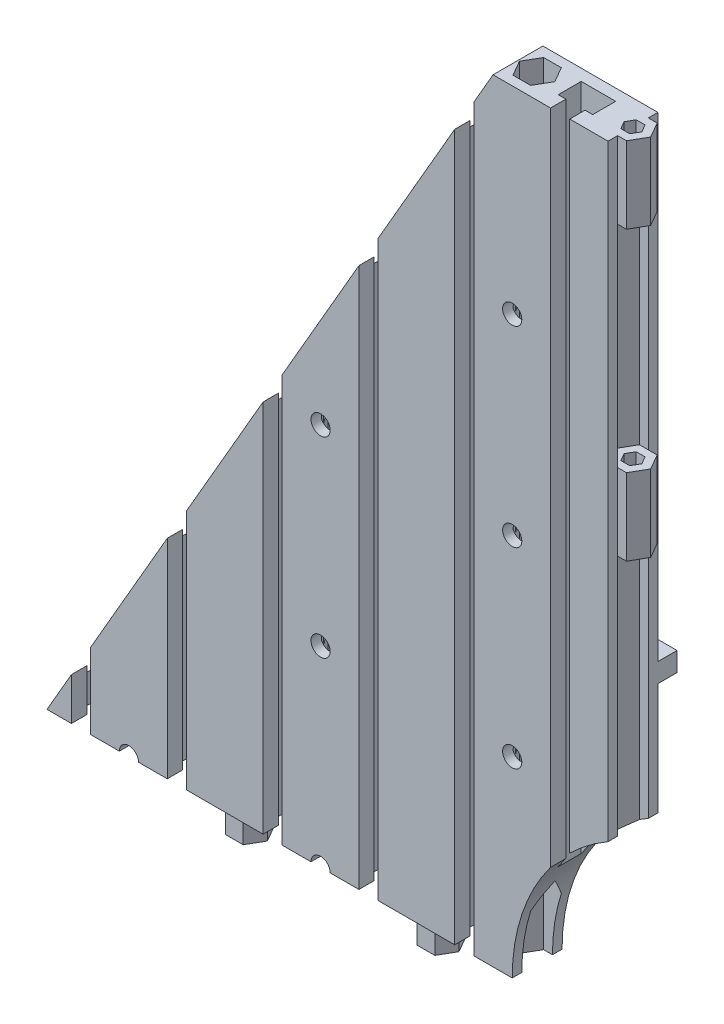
SolidWorks part; units mm, degrees
ref_plane "Plan de face" through (0, 0, 0) normal (0, 0, 1) x (1, 0, 0)
ref_plane "Plan de dessus" through (0, 0, 0) normal (0, 1, 0) x (1, 0, 0)
ref_plane "Plan de droite" through (0, 0, 0) normal (1, 0, 0) x (0, 0, -1)
sketch "Esquisse1" plane through (0, 0, 0) normal (0, 0, 1) x (1, 0, 0)
  line L6 (35.7636, 358.7862) -> (-423.8647, -437.3133) construction
  line L7 (-755.4678, -148.4209) -> (879.7592, -148.4209) construction
  line L8 (-46.1325, 376.7457) -> (415.4529, -422.7436) construction
  line L9 (257.0726, -148.4209) -> (-245.0999, 141.5085) construction
  line L10 (-257.0726, -148.4209) -> (263.2247, 151.9729) construction
  line L11 (-55, 201.5791) -> (55, 201.5791)
  line L12 (-147.0726, -148.4209) -> (147.0726, -148.4209)
  line L13 (147.0726, -148.4209) -> (202.0726, -53.1581)
  line L14 (202.0726, -53.1581) -> (55, 201.5791)
  line L15 (-147.0726, -148.4209) -> (-202.0726, -53.1581)
  line L16 (-202.0726, -53.1581) -> (-55, 201.5791)
  dimension "D1" = 60
  dimension "D2" = 60
  dimension "D3" = 110
  dimension "D4" = 350
  dimension "D5" = 60
  dimension "D6" = 60
  dimension "D7" = 110
  dimension "D8" = 110
extrude "Boss.-Extru.2" add sketch "Esquisse1" along normal blind 13
sketch "Esquisse3" plane through (0, 201.5791, 0) normal (0, 1, 0) x (1, 0, 0)
  line L0 (-12.5, 6.793) -> (-12.5, -19.2478) construction
  line L1 (-8, -3) -> (-17, -3)
  line L2 (-17, -3) -> (-17, -9)
  line L3 (-17, -9) -> (-15, -9)
  line L4 (-15, -9) -> (-15, -13)
  line L5 (55, -13) -> (-55, -13) construction
  line L6 (-10, -9) -> (-10, -13)
  line L7 (-8, -9) -> (-10, -9)
  line L8 (-8, -3) -> (-8, -9)
  line L9 (-15, -13) -> (-10, -13)
  point P2 (-12.5, -13)
  point P14 (-12.5, -3)
  dimension "D1" = 12.5
  dimension "D2" = 9
  dimension "D3" = 5
  dimension "D4" = 6
  dimension "D5" = 4
extrude "Enlèv. mat.-Extru.1" cut sketch "Esquisse3" against normal up to next
pattern_linear "Répétition linéaire1" count 8 spacing 25 along (1, 0, 0) of "Enlèv. mat.-Extru.1"
pattern_linear "Répétition linéaire2" count 7 spacing 25 along (-1, 0, 0) of "Enlèv. mat.-Extru.1"
sketch "certcleRotules" plane through (0, 0, 13) normal (0, 0, 1) x (1, 0, 0)
  circle A0 centre (0, 0) radius 157.5
  dimension "D1" = 315
sketch "Esquisse6" plane through (0, 0, 0) normal (0, 1, 0) x (1, 0, 0)
  line L0 (-157.5, -13) -> (157.5, -13) construction
  line L1 (0, 0) -> (-4.5, 0)
  line L2 (0, 0) -> (0, -13)
  line L3 (-2.5, -9) -> (-4.5, -9)
  line L4 (-4.5, 0) -> (-4.5, -9)
  line L7 (0, -13) -> (-2.5, -13)
  line L8 (-2.5, -9) -> (-2.5, -13)
  dimension "D1" = 4.5
  dimension "D2" = 2.5
  dimension "D3" = 4
revolve "Enlèvement de matière-Révolution1" cut sketch "Esquisse6" angle 360 about L2
pattern_linear "Répétition linéaire3" count 4 spacing 50 along (0, 1, 0) count 4 spacing 50 along (1, 0, 0) of "Enlèvement de matière-Révolution1"
pattern_linear "Répétition linéaire5" count 3 spacing 50 along (0, -1, 0) count 4 spacing 50 along (1, 0, 0) of "Enlèvement de matière-Révolution1"
pattern_linear "Répétition linéaire6" count 4 spacing 50 along (0, 1, 0) count 4 spacing 50 along (-1, 0, 0) of "Enlèvement de matière-Révolution1"
pattern_linear "Répétition linéaire7" count 3 spacing 50 along (0, -1, 0) count 4 spacing 50 along (-1, 0, 0) of "Enlèvement de matière-Révolution1"
sketch "Esquisse8" plane through (0, 0, 0) normal (0, 0, -1) x (-1, 0, 0)
  circle A0 centre (0, 100) radius 4.5 construction
  circle A1 centre (0, 100) radius 4.5
extrude "bouchonBarreauHaut" add sketch "Esquisse8" against normal blind 13
sketch "Esquisse7" plane through (0, 0, 0) normal (0, 0, -1) x (-1, 0, 0)
  line L1 (-6.5, 105.15) -> (6.5, 105.15)
  line L2 (-6.5, 105.15) -> (-6.5, 80.15)
  line L3 (-6.5, 80.15) -> (6.5, 80.15)
  line L4 (6.5, 105.15) -> (6.5, 80.15)
  line L5 (0, 7.15) -> (0, -7.15) construction
  dimension "D1" = 25
  dimension "D2" = 80.15
  dimension "D3" = 13
  dimension "D4" = 6.5
extrude "Boss.-Extru.4" add sketch "Esquisse7" along normal blind 5
sketch "4parties" plane through (0, 0, 0) normal (0, 0, 1) x (1, 0, 0)
  line L0 (-25, 201.5791) -> (-25, 43.3013)
  line L1 (-55, 201.5791) -> (55, 201.5791) construction
  line L2 (-50, 0) -> (-171.3817, 0)
  line L3 (-165, 11.0535) -> (-202.0726, -53.1581) construction
  line L4 (50, 0) -> (171.3817, 0)
  line L5 (202.0726, -53.1581) -> (165, 11.0535) construction
  line L6 (0, -50) -> (0, -148.4209)
  line L7 (-10, -148.4209) -> (10, -148.4209) construction
  circle A0 centre (0, 0) radius 50
  dimension "D1" = 100
  dimension "D2" = 10
sketch "Esquisse9" plane through (0, 0, 0) normal (1, 0, 0) x (0, 0, -1)
  line L0 (5, 80.15) -> (0, 80.15) construction
  line L1 (5, 80.15) -> (5, 105.15) construction
  line L3 (5, 85.15) -> (5, 82.5)
  line L4 (5, 82.5) -> (-3, 82.5)
  line L6 (-3, -148.4209) -> (-3, 201.5791) construction
  line L7 (-13, 157.5) -> (-13, -157.5) construction
  line L8 (-3, 79.15) -> (-13, 79.15)
  line L9 (-3, 79.15) -> (-3, 82.5)
  line L10 (5, 85.15) -> (-13, 85.15)
  line L11 (-13, 79.15) -> (-13, 85.15)
  dimension "D1" = 5
  dimension "D2" = 2.65
  dimension "D3" = 6
revolve "Enlèvement de matière-Révolution2" cut sketch "Esquisse9" angle 360 about L10
pattern_linear "Répétition linéaire8" count 2 spacing 15 along (0, 1, 0) of "Enlèvement de matière-Révolution2"
pattern_circular "Répétition circulaire1" count 3 every 120 about axis through (0, 0, 0) along (0, 0, 1) of "Boss.-Extru.4", "Enlèvement de matière-Révolution2", "Répétition linéaire8"
sketch "Esquisse10" plane through (0, 0, 0) normal (1, 0, 0) x (0, 0, -1)
  line L0 (0, 201.5791) -> (0, -53.1581) construction
  line L1 (0, 77.5) -> (5, 77.5)
  line L2 (0, 77.5) -> (0, 72.5)
  line L3 (0, 72.5) -> (5, 72.5)
  line L4 (5, 77.5) -> (5, 72.5)
  line L5 (0, 50) -> (0, -50) construction
  line L6 (0, -72.5) -> (5, -72.5)
  line L7 (0, -72.5) -> (0, -77.5)
  line L8 (0, -77.5) -> (5, -77.5)
  line L9 (5, -72.5) -> (5, -77.5)
  line L10 (5, 80.15) -> (5, 105.15) construction
  line L11 (-9, 50) -> (0, 50) construction
  line L13 (-9, -100) -> (0, -100) construction
  point P16 (2.5, 72.5)
  point P19 (2.5, -72.5)
  dimension "D1" = 22.5
  dimension "D2" = 5
  dimension "D3" = 22.5
  dimension "D4" = 5
extrude "Boss.-Extru.6" add sketch "Esquisse10" along normal mid plane 250
chamfer "Chanfrein1" distance 5 angle 60 4 edges at (125, -75, -5) (-125, -75, -5) (-125, 75, -5) (125, 75, -5)
sketch "Esquisse11" plane through (0, 0, 13) normal (0, 0, 1) x (1, 0, 0)
  line L0 (-10, -148.4209) -> (-10, 201.5791) construction
  line L1 (-10, 23.5) -> (10, 23.5)
  line L2 (-10, 23.5) -> (-10, -23.5)
  line L3 (-10, -23.5) -> (10, -23.5)
  line L4 (10, 23.5) -> (10, -23.5)
  line L5 (10, -148.4209) -> (10, 201.5791) construction
  dimension "D1" = 47
  dimension "D2" = 23.5
extrude "Enlèv. mat.-Extru.2" cut sketch "Esquisse11" against normal blind 8.9
sketch "Esquisse13" plane through (-8, 0, 0) normal (-1, 0, 0) x (0, 0, 1)
  line L1 (4.1, -23.5) -> (11.1, -23.5)
  line L2 (4.1, -23.5) -> (4.1, -40)
  line L3 (4.1, -40) -> (6.1, -40)
  line L4 (11.1, -23.5) -> (11.1, -35)
  arc A0 (6.1, -40) -> (11.1, -35) centre (6.1, -35) ccw
  dimension "D2" = 5
  dimension "D1" = 16.5
  dimension "D3" = 7
extrude "Enlèv. mat.-Extru.3" cut sketch "Esquisse13" against normal up to surface (16 mm away)
sketch "Esquisse14" plane through (0, 0, 4.1) normal (0, 0, 1) x (1, 0, 0)
  line L0 (-8, 23.5) -> (-8, -40) construction
  line L1 (-3, -20) -> (3, -20)
  line L2 (-8, -25) -> (-8, -35)
  line L3 (-3, -40) -> (3, -40)
  line L4 (8, -25) -> (8, -35)
  line L5 (8, -40) -> (8, 23.5) construction
  line L6 (8, -40) -> (-8, -40) construction
  arc A0 (-8, -35) -> (-3, -40) centre (-3, -35) ccw
  arc A1 (3, -40) -> (8, -35) centre (3, -35) ccw
  arc A2 (3, -20) -> (8, -25) centre (3, -25) cw
  arc A3 (-3, -20) -> (-8, -25) centre (-3, -25) ccw
  point P16 (8, -20)
  point P19 (-8, -20)
  dimension "D3" = 5
  dimension "D1" = 20
extrude "Enlèv. mat.-Extru.4" cut sketch "Esquisse14" against normal up to next
mirror "Symétrie1" about plane through (0, 0, 0) normal (0, 1, 0) of "Enlèv. mat.-Extru.4", "Enlèv. mat.-Extru.3"
sketch "Esquisse15" plane through (0, 0, 0) normal (0, 0, -1) x (-1, 0, 0)
  circle A0 centre (-50, 0) radius 4.5 construction
  circle A1 centre (0, -50) radius 4.5 construction
  circle A2 centre (50, 0) radius 4.5 construction
  circle A3 centre (0, 50) radius 4.5 construction
  circle A4 centre (-50, 0) radius 4.5
  circle A5 centre (0, -50) radius 4.5
  circle A6 centre (50, 0) radius 4.5
  circle A7 centre (0, 50) radius 4.5
extrude "boucheTrousCEntre" add sketch "Esquisse15" against normal up to surface (13 mm away)
sketch "Esquisse16" plane through (0, -148.4209, 0) normal (0, -1, 0) x (1, 0, 0)
  line L0 (0, -9.9) -> (0, 9.9) construction
  line L1 (-2.3094, 2.5) -> (2.3094, 2.5)
  line L2 (2.3094, 2.5) -> (4.6188, 6.5)
  line L3 (4.6188, 6.5) -> (2.3094, 10.5)
  line L4 (2.3094, 10.5) -> (-2.3094, 10.5)
  line L5 (-2.3094, 10.5) -> (-4.6188, 6.5)
  line L6 (-4.6188, 6.5) -> (-2.3094, 2.5)
  line L8 (-10, 13) -> (10, 13) construction
  circle A0 centre (0, 6.5) radius 4 construction
  dimension "D1" = 6.5
  dimension "D2" = 8
extrude "Enlèv. mat.-Extru.5" cut sketch "Esquisse16" against normal through all
pattern_linear "Répétition linéaire9" count 8 spacing 25 along (1, 0, 0) of "Enlèv. mat.-Extru.5"
pattern_linear "Répétition linéaire10" count 8 spacing 25 along (-1, 0, 0) of "Enlèv. mat.-Extru.5"
sketch "Esquisse17" plane through (0, 0, 0) normal (0, 0, -1) x (-1, 0, 0)
  line L0 (25, 201.5791) -> (25, 43.3013) construction
  line L1 (50, 0) -> (171.3817, 0) construction
  line L2 (25, 201.5791) -> (25, 43.3013)
  line L3 (50, 0) -> (171.3817, 0)
  line L6 (202.0726, -53.1581) -> (55, 201.5791)
  line L7 (55, 201.5791) -> (-55, 201.5791)
  line L8 (-55, 201.5791) -> (-202.0726, -53.1581)
  line L9 (-202.0726, -53.1581) -> (-147.0726, -148.4209)
  line L10 (-147.0726, -148.4209) -> (147.0726, -148.4209)
  line L11 (147.0726, -148.4209) -> (202.0726, -53.1581)
  line L12 (202.0726, -53.1581) -> (171.3817, 0)
  line L13 (25, 201.5791) -> (-55, 201.5791)
  line L14 (-55, 201.5791) -> (-202.0726, -53.1581)
  line L15 (-202.0726, -53.1581) -> (-147.0726, -148.4209)
  line L16 (-147.0726, -148.4209) -> (147.0726, -148.4209)
  line L17 (147.0726, -148.4209) -> (202.0726, -53.1581)
  circle A0 centre (0, 0) radius 50 construction
  arc A1 (50, 0) -> (25, 43.3013) centre (0, 0) ccw
  dimension "D1" = 0
extrude "Enlèv. mat.-Extru.6" cut sketch "Esquisse17" against normal through all both and the other way through all
sketch "Esquisse18" plane through (0, 201.5791, 0) normal (0, 1, 0) x (1, 0, 0)
  line L0 (-29.6188, -6.5) -> (-27.3094, -2.5) construction
  line L1 (-27.3094, -2.5) -> (-29.6188, -6.5)
  line L2 (-29.6188, -6.5) -> (-27.3094, -10.5)
  line L3 (-27.3094, -10.5) -> (-22.6906, -10.5)
  line L4 (-22.6906, -10.5) -> (-20.3812, -6.5)
  line L5 (-20.3812, -6.5) -> (-22.6906, -2.5)
  line L6 (-22.6906, -2.5) -> (-27.3094, -2.5)
  line L7 (-27.3094, -10.5) -> (-29.6188, -6.5) construction
  line L8 (-25, -10.5) -> (-27.3094, -10.5) construction
  line L10 (-23.8453, -8.5) -> (-22.6906, -6.5)
  line L11 (-22.6906, -6.5) -> (-23.8453, -4.5)
  line L12 (-23.8453, -4.5) -> (-26.1547, -4.5)
  line L13 (-26.1547, -4.5) -> (-27.3094, -6.5)
  line L14 (-27.3094, -6.5) -> (-26.1547, -8.5)
  line L15 (-26.1547, -8.5) -> (-23.8453, -8.5)
  circle A0 centre (-25, -6.5) radius 4 construction
  circle A1 centre (-25, -6.5) radius 2 construction
  dimension "D1" = 2
extrude "Boss.-Extru.7" add sketch "Esquisse18" against normal blind 20
sketch "Esquisse19" plane through (0, 0, 0) normal (0, -1, 0) x (1, 0, 0)
  line L6 (-70.3812, 6.5) -> (-72.6906, 10.5) construction
  line L7 (-72.6906, 2.5) -> (-70.3812, 6.5) construction
  line L8 (-77.3094, 2.5) -> (-72.6906, 2.5) construction
  line L9 (-79.6188, 6.5) -> (-77.3094, 2.5) construction
  line L10 (-77.3094, 10.5) -> (-79.6188, 6.5) construction
  line L11 (-72.6906, 10.5) -> (-77.3094, 10.5) construction
  line L18 (-70.3812, 6.5) -> (-72.6906, 10.5)
  line L19 (-72.6906, 2.5) -> (-70.3812, 6.5)
  line L20 (-77.3094, 2.5) -> (-72.6906, 2.5)
  line L21 (-79.6188, 6.5) -> (-77.3094, 2.5)
  line L22 (-77.3094, 10.5) -> (-79.6188, 6.5)
  line L23 (-72.6906, 10.5) -> (-77.3094, 10.5)
  line L25 (-73.8453, 4.5) -> (-72.6906, 6.5)
  line L26 (-72.6906, 6.5) -> (-73.8453, 8.5)
  line L27 (-73.8453, 8.5) -> (-76.1547, 8.5)
  line L28 (-76.1547, 8.5) -> (-77.3094, 6.5)
  line L29 (-77.3094, 6.5) -> (-76.1547, 4.5)
  line L30 (-76.1547, 4.5) -> (-73.8453, 4.5)
  circle A0 centre (-75, 6.5) radius 2 construction
  dimension "D3" = 4
  dimension "D1" = 2
  dimension "D2" = 2
extrude "Boss.-Extru.8" add sketch "Esquisse19" along normal mid plane 15
pattern_linear "Répétition linéaire11" count 2 spacing 50 along (-1, 0, 0) of "Boss.-Extru.8"
pattern_linear "Répétition linéaire12" count 2 spacing 75 along (0, -1, 0) of "Boss.-Extru.7"
